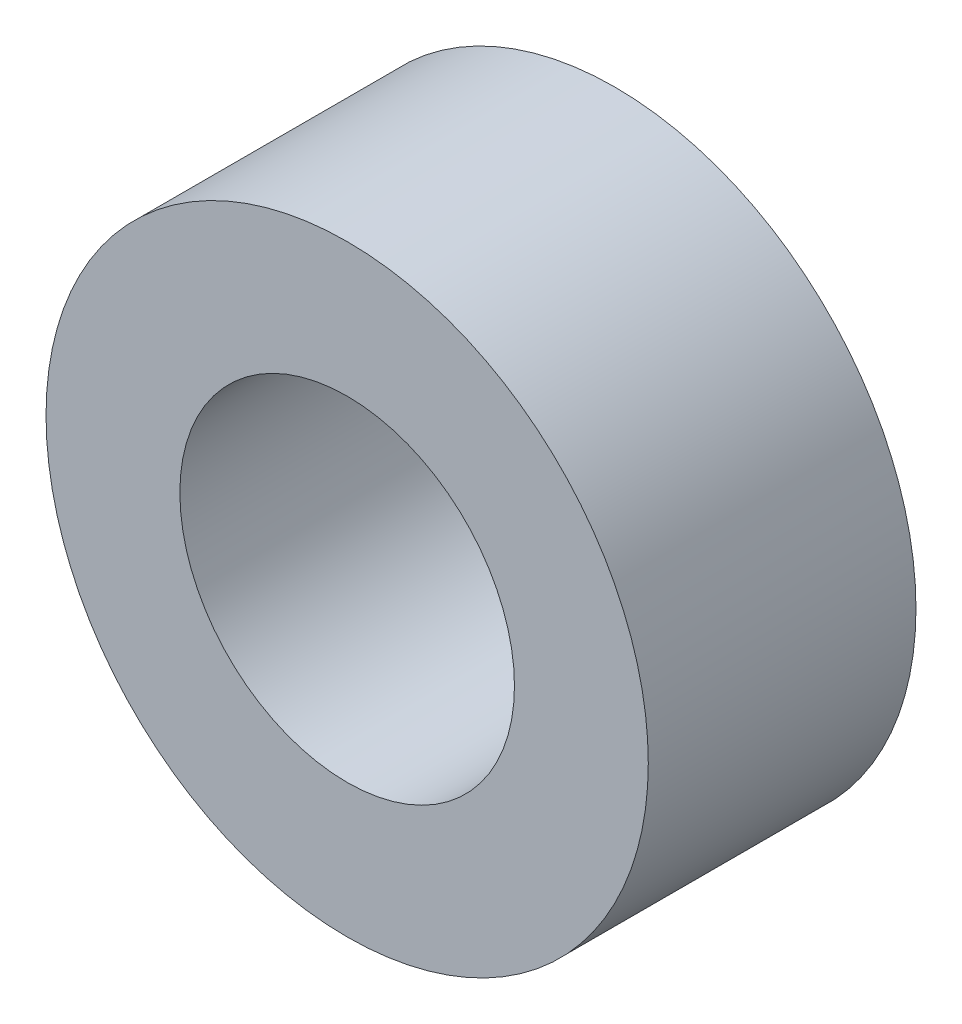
SolidWorks part; units mm, degrees
ref_plane "Plano frontal" through (0, 0, 0) normal (0, 0, 1) x (1, 0, 0)
ref_plane "Plano superior" through (0, 0, 0) normal (0, 1, 0) x (1, 0, 0)
ref_plane "Plano direito" through (0, 0, 0) normal (1, 0, 0) x (0, 0, -1)
sketch "Esboço1" plane through (0, 0, 0) normal (0, 0, 1) x (1, 0, 0)
  circle A0 centre (0, 0) radius 2.5
  circle A1 centre (0, 0) radius 4.5
  dimension "D1" = 5
  dimension "D2" = 9
extrude "Ressalto-extrusão1" add sketch "Esboço1" along normal blind 4
